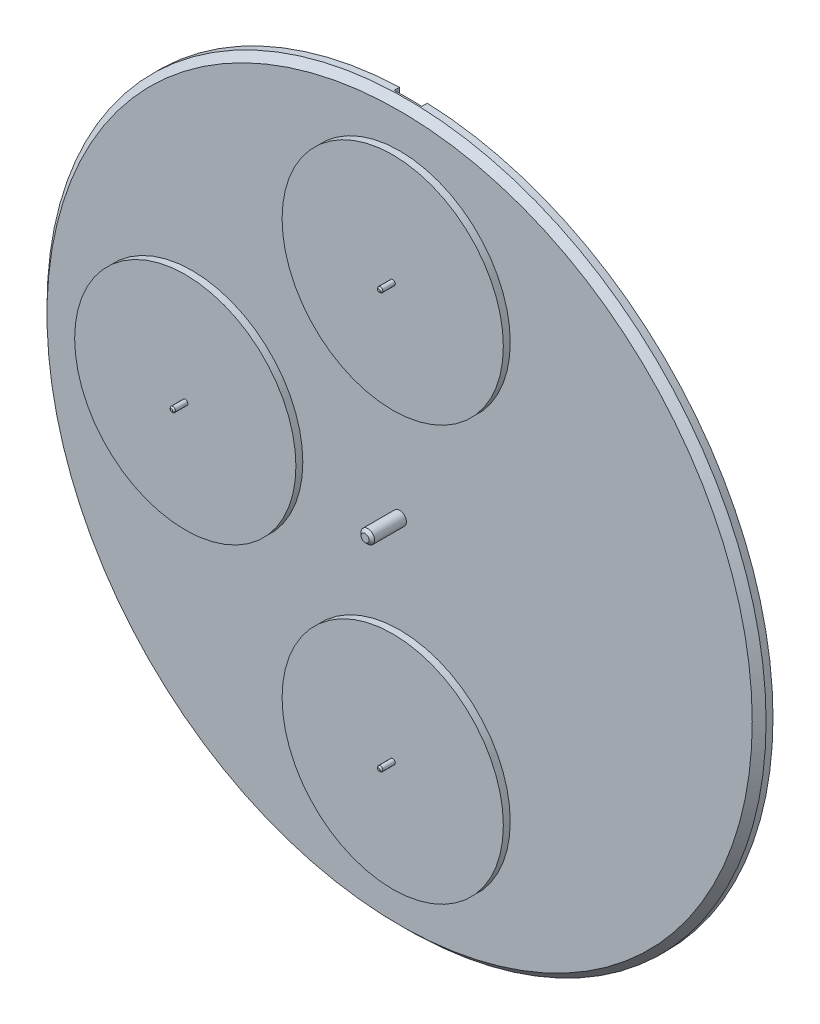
SolidWorks part; units mm, degrees
ref_plane "Front" through (0, 0, 0) normal (0, 0, 1) x (1, 0, 0)
ref_plane "Top" through (0, 0, 0) normal (0, 1, 0) x (1, 0, 0)
ref_plane "Right" through (0, 0, 0) normal (1, 0, 0) x (0, 0, -1)
sketch "Sketch1" plane through (0, 0, 0) normal (0, 0, 1) x (1, 0, 0)
  circle A4 centre (0, 0) radius 13
  dimension "D1" = 26
extrude "Base-Extrude" add sketch "Sketch1" against normal blind 0.5
sketch "Sketch2" plane through (0, 0, 0) normal (0, 0, 1) x (1, 0, 0)
  line L0 (-19.6851, 0) -> (20.2961, 0) construction
  line L1 (0, 17.3189) -> (0, -16.8635) construction
  circle A0 centre (10, 0) radius 1.75 construction
  circle A1 centre (-7.5, 0) radius 4
  circle A2 centre (0, 7.5) radius 4
  circle A3 centre (0, -7.5) radius 4
  point P12 (0, 0)
  dimension "D1" = 8
  dimension "D2" = 8
  dimension "D3" = 8
  dimension "D4" = 3.5
  dimension "D5" = 10
  dimension "D6" = 7.5
  dimension "D7" = 7.5
  dimension "D8" = 7.5
extrude "Boss-Extrude1" add sketch "Sketch2" along normal blind 0.25
sketch "Sketch3" plane through (0, 0, 0) normal (0, 0, 1) x (1, 0, 0)
  circle A0 centre (-7.5, 0) radius 0.0937
  circle A2 centre (0, 7.5) radius 0.0938
  circle A3 centre (0, -7.5) radius 0.0938
  dimension "D1" = 0.1875
  dimension "D2" = 0.1875
  dimension "D3" = 0.1875
extrude "Boss-Extrude2" add sketch "Sketch3" along normal blind 0.75
sketch "Sketch4" plane through (0, 0, 0) normal (0, 0, 1) x (1, 0, 0)
  circle A0 centre (0, 0) radius 0.245
  dimension "D1" = 0.49
extrude "Boss-Extrude3" add sketch "Sketch4" along normal blind 1.25
sketch "Sketch5" plane through (0, 0, -0.5) normal (0, 0, -1) x (-1, 0, 0)
  line L0 (0, 0) -> (0, 10.4664) construction
  line L2 (0.5, 12) -> (-0.5, 12)
  line L3 (0.5, 12) -> (0.5, 14)
  line L4 (0.5, 14) -> (-0.5, 14)
  line L5 (-0.5, 12) -> (-0.5, 14)
  circle A1 centre (0, 0) radius 13
  circle A2 centre (0, 0) radius 13 construction
  point P8 (0, 12)
  dimension "D2" = 12
  dimension "D3" = 2
  dimension "D4" = 1
  dimension "D1" = 0
extrude "Cut-Extrude1" cut sketch "Sketch5" against normal blind 0.2
chamfer "Chamfer1" distance 0.1 angle 45 1 edges at (0.245, 0, 1.25)
chamfer "Chamfer2" distance 0.05 angle 45 3 edges at (-7.4062, 0, 0.75) (0.0938, 7.5, 0.75) (0.0938, -7.5, 0.75)
chamfer "Chamfer4" distance 0.25 angle 45 1 edges at (13, 0, 0)
